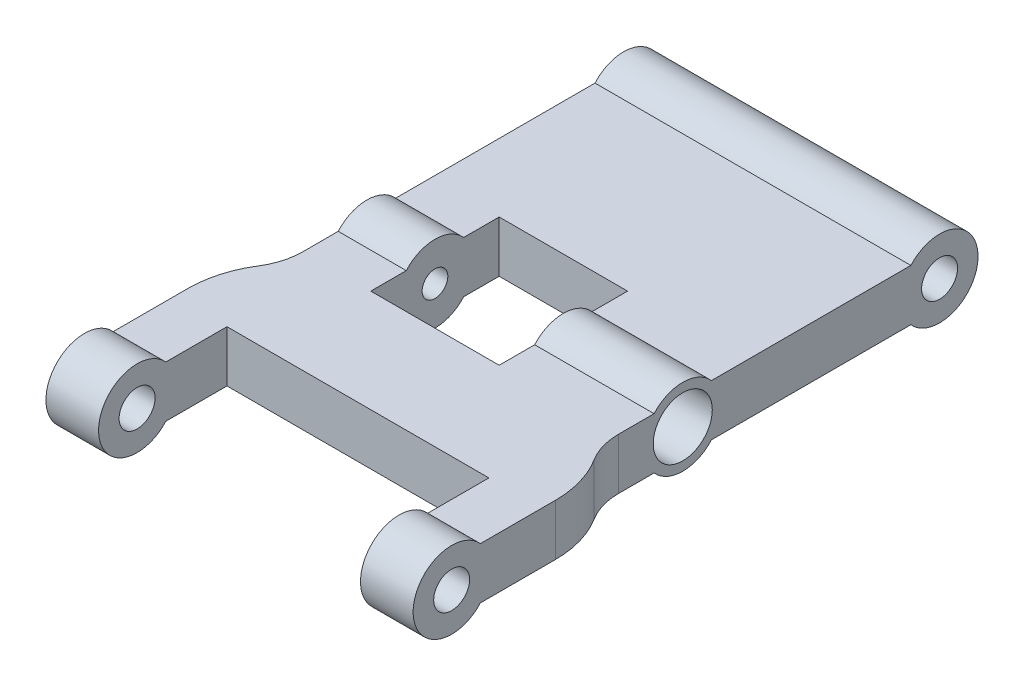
SolidWorks part; units mm, degrees
ref_plane "Front Plane" through (0, 0, 0) normal (0, 0, 1) x (1, 0, 0)
ref_plane "Top Plane" through (0, 0, 0) normal (0, 1, 0) x (1, 0, 0)
ref_plane "Right Plane" through (0, 0, 0) normal (1, 0, 0) x (0, 0, -1)
sketch "Sketch1" plane through (0, 0, 0) normal (1, 0, 0) x (0, 0, -1)
  line L1 (0, 0) -> (50.8, 0)
  line L2 (0, 0) -> (0, 5.08)
  line L3 (0, 5.08) -> (50.8, 5.08)
  line L4 (50.8, 0) -> (50.8, 5.08)
  dimension "D1" = 5.08
  dimension "D2" = 50.8
extrude "Boss-Extrude1" add sketch "Sketch1" along normal blind 31.242
sketch "Sketch2" plane through (31.242, 0, 0) normal (1, 0, 0) x (0, 0, -1)
  line L0 (0, 5.08) -> (0, 0) construction
  line L1 (50.8, 0) -> (50.8, 5.08) construction
  circle A0 centre (0, 2.54) radius 3.81
  circle A1 centre (50.8, 2.54) radius 3.81
  dimension "D1" = 7.62
  dimension "D2" = 7.62
extrude "Boss-Extrude2" add sketch "Sketch2" against normal blind 31.242
sketch "Sketch4" plane through (0, 5.08, 0) normal (0, 1, 0) x (1, 0, 0)
  line L0 (-3.3841, 25.4) -> (39.1226, 25.4) construction
  line L2 (6.731, 31.75) -> (19.431, 31.75)
  line L3 (6.731, 31.75) -> (6.731, 19.05)
  line L4 (6.731, 19.05) -> (19.431, 19.05)
  line L5 (19.431, 31.75) -> (19.431, 19.05)
  line L6 (15.621, 56.2152) -> (15.621, -6.3549) construction
  dimension "D1" = 25.4
  dimension "D3" = 12.7
  dimension "D4" = 12.7
  dimension "D5" = 6.35
  dimension "D6" = 3.81
sketch "Sketch5" plane through (0, 0, 0) normal (-1, 0, 0) x (0, 0, 1)
  line L0 (-47.9602, 5.08) -> (-2.8398, 5.08) construction
  circle A0 centre (-25.4, 2.54) radius 1.27
  dimension "D1" = 2.54
  dimension "D2" = 2.54
sketch "Sketch6" plane through (0, 0, 0) normal (-1, 0, 0) x (0, 0, 1)
  circle A0 centre (-50.8, 2.54) radius 1.778
  circle A2 centre (0, 2.54) radius 1.778
  dimension "D1" = 3.556
  dimension "D2" = 3.556
sketch "Sketch7" plane through (0, 0, 0) normal (-1, 0, 0) x (0, 0, 1)
  circle A0 centre (-25.4, 2.54) radius 3.81
  arc A1 (-47.9602, 5.08) -> (-47.9602, 0) centre (-50.8, 2.54) ccw construction
extrude "Boss-Extrude3" add sketch "Sketch7" against normal up to surface (31.242 mm away)
extrude "Cut-Extrude5" cut sketch "Sketch5" against normal through all
extrude "Cut-Extrude6" cut sketch "Sketch4" against normal through all both and the other way through all
sketch "Sketch8" plane through (31.242, 0, 0) normal (1, 0, 0) x (0, 0, -1)
  circle A0 centre (25.4, 2.54) radius 2.921
  dimension "D1" = 5.842
extrude "Cut-Extrude7" cut sketch "Sketch8" against normal offset from surface (9.271 mm away) 2.54
sketch "Sketch9" plane through (0, 0, 0) normal (-1, 0, 0) x (0, 0, 1)
  circle A0 centre (-25.4, 2.54) radius 2.921
  dimension "D1" = 5.842
extrude "Cut-Extrude8" cut sketch "Sketch9" against normal offset from surface (4.191 mm away) 2.54
sketch "Sketch10" plane through (31.242, 0, 0) normal (1, 0, 0) x (0, 0, -1)
  line L0 (2.8398, 0) -> (22.5602, 0) construction
  line L1 (2.8398, 5.08) -> (19.05, 5.08)
  line L3 (2.8398, 0) -> (19.05, 0)
  line L4 (19.05, 5.08) -> (19.05, 0)
  arc A0 (2.8398, 5.08) -> (2.8398, 0) centre (0, 2.54) ccw
  dimension "D1" = 19.05
extrude "Boss-Extrude4" add sketch "Sketch10" along normal blind 2.54 and the other way blind 33.782
sketch "Sketch11" plane through (0, 5.08, 0) normal (0, 1, 0) x (1, 0, 0)
  line L0 (-2.54, 19.05) -> (0, 19.05) construction
  line L1 (0, 22.5602) -> (-7.62, 22.5602)
  line L2 (0, 22.5602) -> (0, 19.05)
  line L3 (-6.35, 12.7) -> (-7.62, 12.7)
  line L4 (-7.62, 22.5602) -> (-7.62, 12.7)
  line L5 (31.242, 22.5602) -> (38.862, 22.5602)
  line L6 (31.242, 22.5602) -> (31.242, 19.05)
  line L7 (37.592, 12.7) -> (38.862, 12.7)
  line L8 (38.862, 22.5602) -> (38.862, 12.7)
  line L9 (31.242, 19.05) -> (33.782, 19.05) construction
  arc A0 (31.242, 19.05) -> (37.592, 12.7) centre (37.592, 19.05) ccw
  arc A1 (0, 19.05) -> (-6.35, 12.7) centre (-6.35, 19.05) cw
  dimension "D5" = 6.35
  dimension "D1" = 7.62
  dimension "D2" = 7.62
  dimension "D3" = 6.35
  dimension "D4" = 6.35
extrude "Cut-Extrude9" cut sketch "Sketch11" against normal through all
fillet "Fillet1" radius 10.16 2 edges at (33.782, 2.54, -13.97) (-2.54, 2.54, -13.97)
sketch "Sketch12" plane through (0, 5.08, 0) normal (0, 1, 0) x (1, 0, 0)
  line L1 (2.667, 8.89) -> (28.575, 8.89)
  line L2 (2.667, 8.89) -> (2.667, -7.1033)
  line L3 (2.667, -7.1033) -> (28.575, -7.1033)
  line L4 (28.575, 8.89) -> (28.575, -7.1033)
  line L5 (-2.54, 10.2512) -> (-2.54, 2.8398) construction
  dimension "D1" = 12.7
  dimension "D2" = 25.908
  dimension "D3" = 5.207
extrude "Cut-Extrude10" cut sketch "Sketch12" against normal through all both and the other way through all
extrude "Cut-Extrude11" cut sketch "Sketch6" against normal through all both and the other way through all
